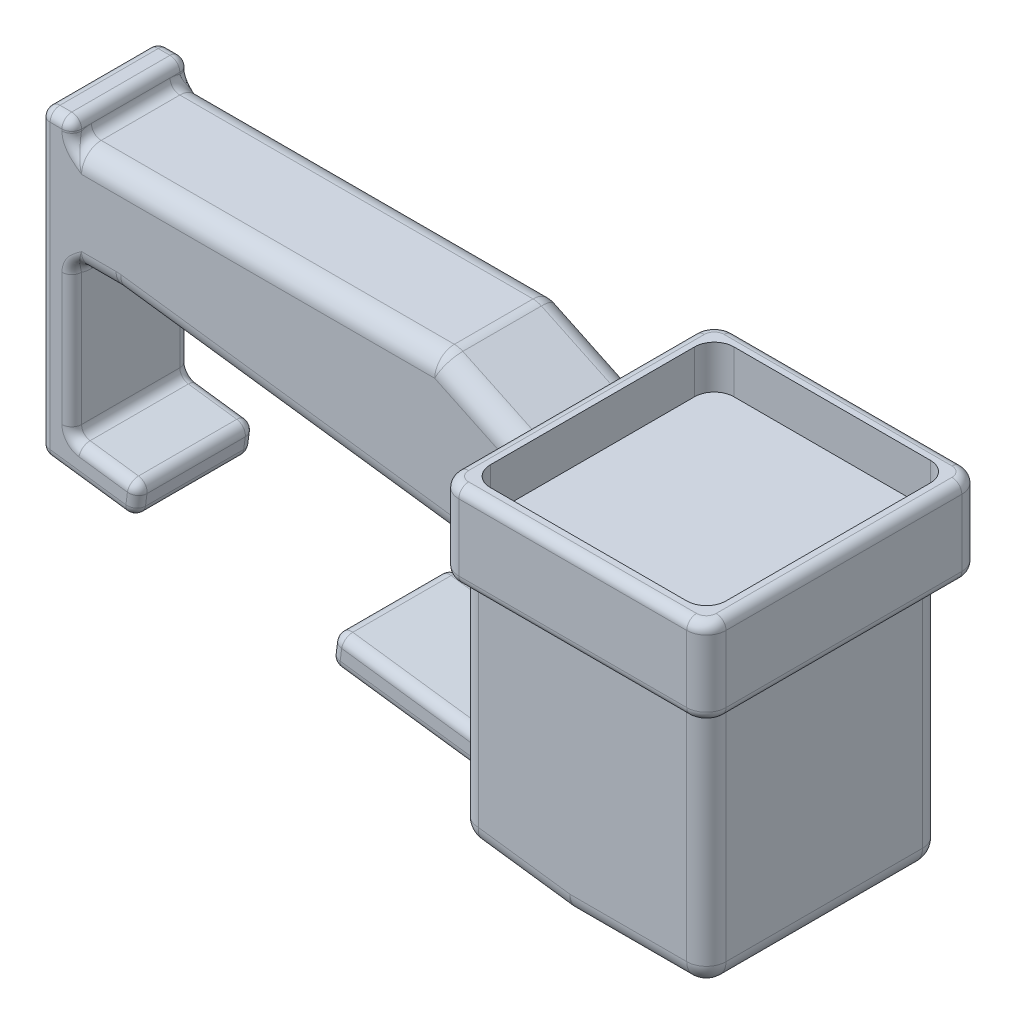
SolidWorks part; units mm, degrees
ref_plane "Plan1" through (0, 0, 0) normal (0, 0, 1) x (1, 0, 0)
ref_plane "Plan2" through (0, 0, 0) normal (0, 1, 0) x (1, 0, 0)
ref_plane "Plan3" through (0, 0, 0) normal (1, 0, 0) x (0, 0, -1)
sketch "Esquisse1" plane through (0, 0, 0) normal (0, 0, 1) x (1, 0, 0)
  line L0 (-30, 0) -> (30, 0)
  line L1 (30, 0) -> (30, 11)
  line L2 (30, 11) -> (34, 11)
  line L3 (34, 11) -> (34, -11)
  line L4 (34, -11) -> (29.5, -11)
  line L5 (29.5, -11) -> (29.5, -74.5)
  line L6 (29.5, -74.5) -> (-6.0425, -74.5)
  line L7 (-6.0425, -74.5) -> (-82, -64.5)
  line L8 (-82, -64.5) -> (-80.9558, -56.5684)
  line L9 (-80.9558, -56.5684) -> (-37, -62.3553)
  line L10 (-37, -62.3553) -> (-37, -23.0188)
  line L11 (-147.5, -10) -> (-135.8876, -10)
  line L12 (-147.5, -10) -> (-147.5, -47.8077)
  line L13 (-147.5, -47.8077) -> (-130.528, -50.0421)
  line L14 (-130.528, -50.0421) -> (-131.5722, -57.9737)
  line L15 (-131.5722, -57.9737) -> (-155.5, -54.8235)
  line L16 (-155.5, -54.8235) -> (-155.5, 22)
  line L17 (-155.5, 22) -> (-147.5, 22)
  line L18 (-147.5, 22) -> (-147.5, 17)
  line L19 (-147.5, 17) -> (-54, 17)
  line L20 (-54, 17) -> (-34, 7.5)
  line L21 (-34, 7.5) -> (-34, 11)
  line L22 (-34, 11) -> (-30, 11)
  line L23 (-30, 11) -> (-30, 0)
  line L24 (-135.8876, -10) -> (-37, -23.0188)
  dimension "D1" = 60
  dimension "D2" = 11
  dimension "D3" = 4
  dimension "D4" = 22
  dimension "D5" = 4.5
  dimension "D6" = 85.5
  dimension "D7" = 8
  dimension "D8" = 7.5
  dimension "D9" = 66.5
  dimension "D10" = 39
  dimension "D11" = 45
  dimension "D12" = 10
  dimension "D13" = 50
  dimension "D14" = 185
  dimension "D15" = 8
  dimension "D16" = 6
  dimension "D17" = 20
  dimension "D18" = 3.5
  dimension "D19" = 5
  dimension "D20" = 27
extrude "Base-Extrusion" add sketch "Esquisse1" along normal mid plane 70
sketch "Esquisse2" plane through (0, 0, 0) normal (0, 1, 0) x (-1, 0, 0)
  line L1 (-30, 35) -> (30, 35)
  line L2 (-30, 35) -> (-30, 31)
  line L3 (-30, 31) -> (30, 31)
  line L4 (30, 35) -> (30, 31)
  line L5 (30, 35) -> (30, -35) construction
  line L6 (-30, 35) -> (-30, -35) construction
  line L7 (-30, 35) -> (30, 35) construction
  line L8 (-34, 35) -> (-30, 35) construction
  line L9 (-39.0649, 0) -> (39.0649, 0) construction
  line L10 (30, -35) -> (30, -31)
  line L11 (-30, -31) -> (30, -31)
  line L12 (-30, -35) -> (-30, -31)
  line L13 (-30, -35) -> (30, -35)
extrude "Boss.-Extru.1" add sketch "Esquisse2" along normal up to surface (11 mm away)
sketch "Esquisse3" plane through (0, 22, 0) normal (0, 1, 0) x (-1, 0, 0)
  line L0 (155.5, 35) -> (155.5, -35) construction
  line L1 (34, -35) -> (155.5, -35)
  line L2 (34, -35) -> (34, -15)
  line L3 (34, -15) -> (155.5, -15)
  line L4 (155.5, -35) -> (155.5, -15)
  line L5 (34, 35) -> (34, -35) construction
  line L6 (54, -35) -> (147.5, -35) construction
  line L7 (-39.377, 0) -> (159.1601, 0) construction
  line L8 (155.5, 35) -> (155.5, 15)
  line L9 (34, 15) -> (155.5, 15)
  line L10 (34, 35) -> (34, 15)
  line L11 (34, 35) -> (155.5, 35)
  dimension "D1" = 30
extrude "Enlèv. mat.-Extru.1" cut sketch "Esquisse3" against normal through all
sketch "Esquisse4" plane through (0, -74.5, 0) normal (0, -1, 0) x (1, 0, 0)
  line L0 (29, 30) -> (29, -30)
  line L1 (29, -30) -> (-34, -30)
  line L2 (-34, -30) -> (-34, -35)
  line L3 (-34, -35) -> (34, -35)
  line L4 (34, -35) -> (34, 35)
  line L5 (34, 35) -> (-34, 35)
  line L6 (-34, 35) -> (-34, 30)
  line L7 (-34, 30) -> (29, 30)
  line L8 (-6.0425, -35) -> (29.5, -35) construction
  line L9 (-34, -15) -> (-34, -35) construction
  line L10 (34, 35) -> (34, -35) construction
  line L11 (-6.0425, 35) -> (29.5, 35) construction
  line L12 (29, 0) -> (34, 0) construction
  dimension "D1" = 60
extrude "Enlèv. mat.-Extru.2" cut sketch "Esquisse4" against normal up to surface (63.5 mm away)
fillet "Congé1" radius 5
fillet "Congé2" radius 5
fillet "Congé3" radius 2.5
fillet "Congé8" radius 5
fillet "Congé9" radius 2.5
